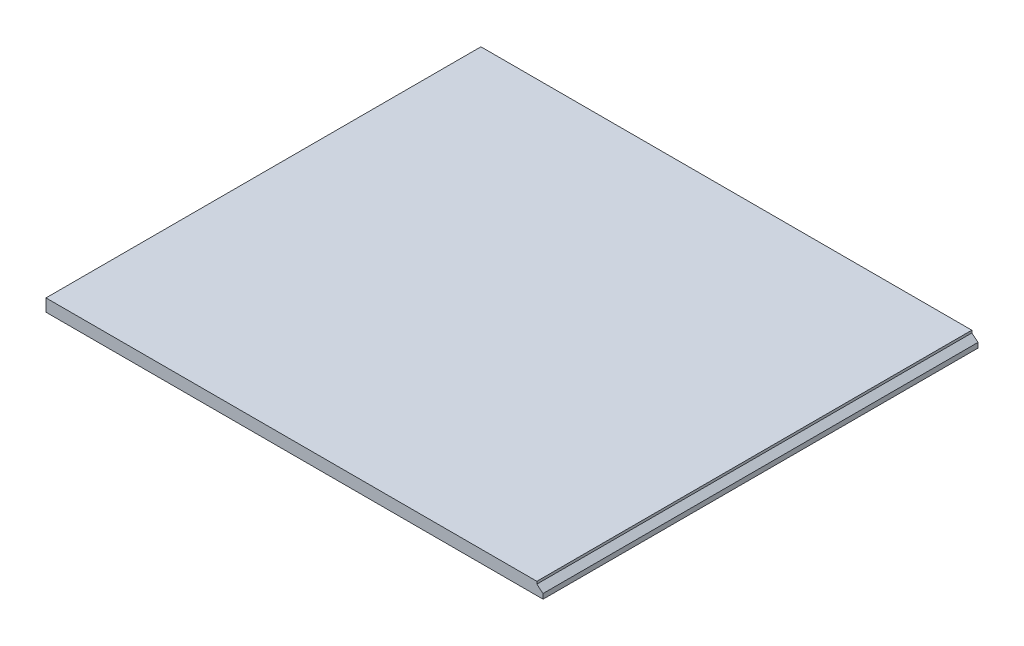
SolidWorks part; units mm, degrees
ref_plane "Plan de face" through (0, 0, 0) normal (0, 0, 1) x (1, 0, 0)
ref_plane "Plan de dessus" through (0, 0, 0) normal (0, 1, 0) x (1, 0, 0)
ref_plane "Plan de droite" through (0, 0, 0) normal (1, 0, 0) x (0, 0, -1)
sketch "Esquisse1" plane through (0, 0, 0) normal (0, 0, 1) x (1, 0, 0)
  line L0 (0, 0) -> (0, -1000)
  line L1 (0, -1000) -> (40000, -1000)
  line L2 (40000, -1000) -> (40000, -600)
  line L3 (39500, 0) -> (0, 0)
  line L4 (39500, 0) -> (39500, -200)
  line L5 (39500, -200) -> (40000, -600)
  arc A0 (40000, -600) -> (0, 0) centre (18530.4784, -98268.1096) ccw construction
  dimension "D4" = 100000
  dimension "D1" = 40000
  dimension "D2" = 1000
  dimension "D3" = 400
  dimension "D5" = 1000
  dimension "D6" = 800
  dimension "35000" = 39500
extrude "Boss.-Extru.1" add sketch "Esquisse1" against normal blind 30000 and the other way blind 5000
sketch "Esquisse2" plane through (0, -1000, 0) normal (0, 1, 0) x (1, 0, 0)
  line L0 (5000, 15050) -> (5000, 15200)
  line L1 (4900, 14800) -> (5000, 14800)
  line L2 (4900, 14800) -> (4900, 15200)
  line L3 (4900, 15200) -> (5000, 15200)
  line L4 (5000, 14800) -> (5000, 14950)
  line L5 (5000, 15000) -> (4900, 15000) construction
  arc A0 (5000, 14950) -> (5000, 15050) centre (5000, 15000) ccw
  dimension "D1" = 100
  dimension "D2" = 5000
  dimension "D3" = 400
  dimension "D4" = 100
  dimension "D5" = 15000
extrude "Enlèv. mat.-Extru.1" cut sketch "Esquisse2" along normal blind 100
sketch "Esquisse3" plane through (0, 0, 0) normal (0, 1, 0) x (1, 0, 0)
  line L0 (8917.5599, 0) -> (8917.5599, 5000) construction
  line L1 (8917.5599, 0) -> (8917.5599, 5000) construction
  line L2 (8917.5599, 5000) -> (18380.534, 5000) construction
  line L3 (18274.4701, 0) -> (23268.9548, 0) construction
  circle A0 centre (8917.5599, 5000) radius 5000
  point P0 (8917.5599, 5000)
  dimension "D2" = 10000
  dimension "D1" = 0
sketch "Esquisse4" plane through (0, 0, 0) normal (0, 1, 0) x (1, 0, 0)
  line L0 (39600, -5000) -> (39600, 600)
  line L1 (39500, -5000) -> (0, -5000) construction
  line L2 (39600, 600) -> (39500, 600)
  line L3 (39500, 30000) -> (39500, -5000) construction
  line L4 (39500, 600) -> (39500, -5000)
  line L5 (39500, -5000) -> (39600, -5000)
  dimension "D1" = 600
  dimension "D2" = 100
extrude "Enlèv. mat.-Extru.2" [suppressed] cut sketch "Esquisse4" against normal up to vertex
